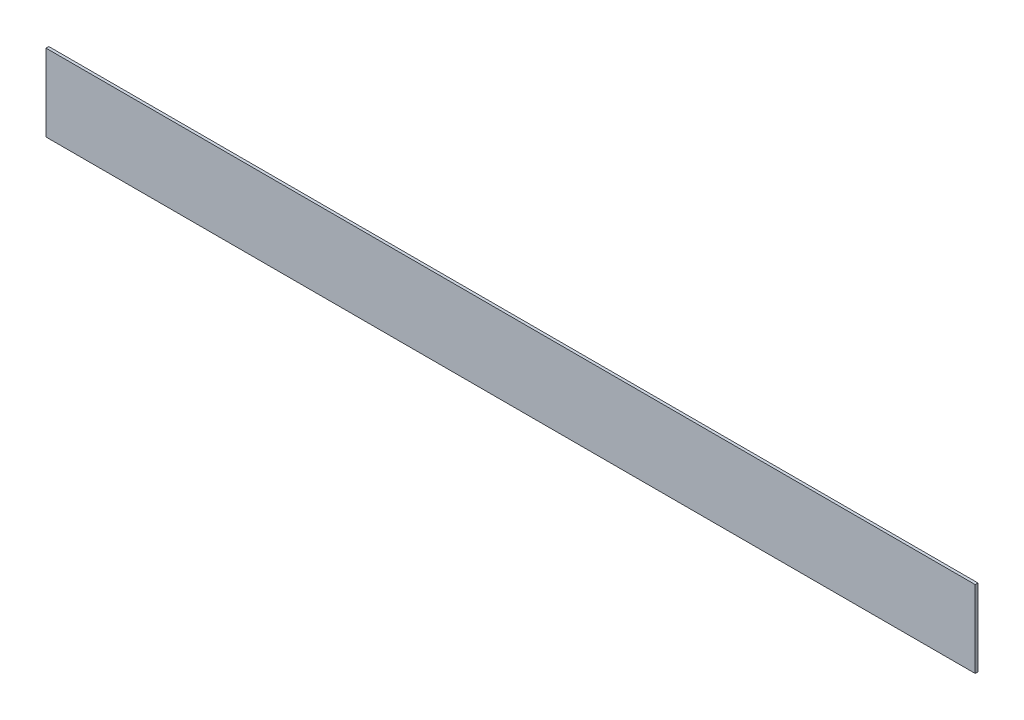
SolidWorks part; units mm, degrees
ref_plane "Alzado" through (0, 0, 0) normal (0, 0, 1) x (1, 0, 0)
ref_plane "Planta" through (0, 0, 0) normal (0, 1, 0) x (1, 0, 0)
ref_plane "Vista lateral" through (0, 0, 0) normal (1, 0, 0) x (0, 0, -1)
sketch "Croquis1" plane through (0, 0, 0) normal (0, 0, 1) x (1, 0, 0)
  line L2 (227.8931, -1075.9719) -> (227.8931, -661.7019)
  line L4 (227.8931, -661.7019) -> (5227.8931, -661.7019)
  line L5 (227.8931, -661.7019) -> (227.8931, -1075.9719)
  line L6 (227.8931, -1075.9719) -> (5227.8931, -1075.9719)
  line L7 (5227.8931, -661.7019) -> (5227.8931, -1075.9719)
  dimension "D5" = 414.27
extrude "Saliente-Extruir1" add sketch "Croquis1" along normal blind 15 contours L7 L4 L2 L6
